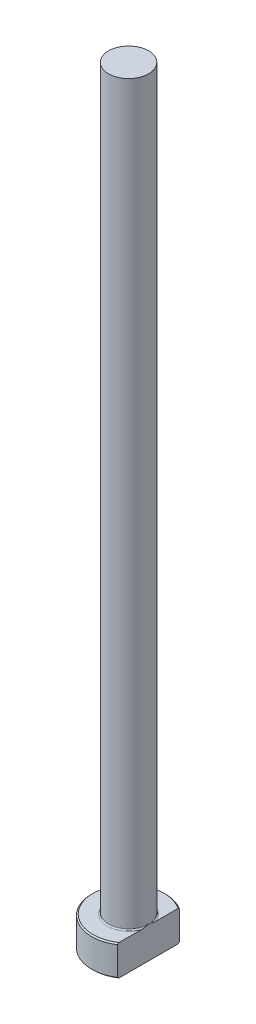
SolidWorks part; units mm, degrees
ref_plane "Front Plane" through (0, 0, 0) normal (0, 0, 1) x (1, 0, 0)
ref_plane "Top Plane" through (0, 0, 0) normal (0, 1, 0) x (1, 0, 0)
ref_plane "Right Plane" through (0, 0, 0) normal (1, 0, 0) x (0, 0, -1)
sketch "Sketch1" plane through (0, 0, 0) normal (0, 0, 1) x (1, 0, 0)
  line L0 (0, 259.9588) -> (0, -15.1925) construction
  line L1 (0, 0) -> (-6, 0)
  line L2 (-6, 0) -> (-6, 5)
  line L3 (-6, 5) -> (-3.25, 5)
  line L4 (-3.25, 5) -> (-3.25, 125)
  line L5 (-3.25, 125) -> (0, 125)
  line L6 (0, 125) -> (0, 0)
  dimension "L" = 125
  dimension "H" = 12
  dimension "T" = 5
  dimension "D" = 6.5
revolve "Revolve1" add sketch "Sketch1" angle 360 about L0
chamfer "Chamfer1" distance 0.2 angle 45 2 edges at (0, 5, 6) (0, 0, 6)
fillet "Fillet1" radius 0.2 1 edges at (0, 5, 3.25)
sketch "Sketch2" plane through (0, 0, 0) normal (0, 1, 0) x (1, 0, 0)
  line L0 (3.25, 5.0436) -> (3.25, -5.0436)
  circle A0 centre (0, 0) radius 6 construction
  arc A1 (3.25, -5.0436) -> (3.25, 5.0436) centre (0, 0) ccw
  circle A2 centre (0, 0) radius 3.25 construction
extrude "KEY" cut sketch "Sketch2" along normal through all
